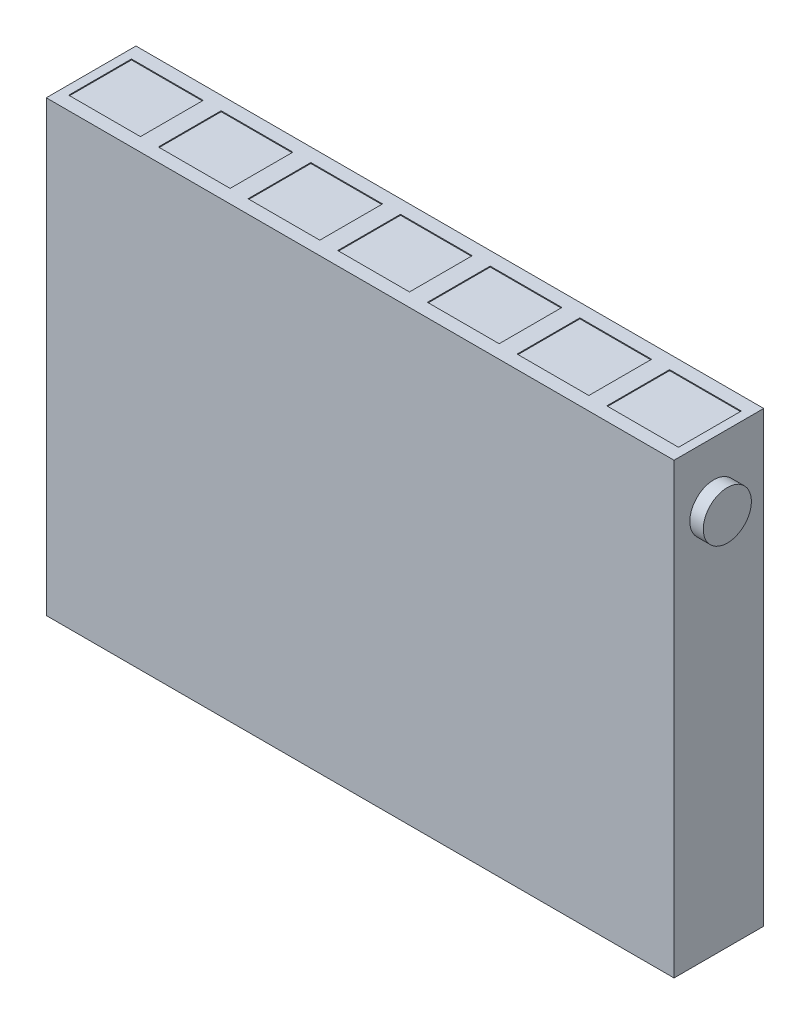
SolidWorks part; units mm, degrees
ref_plane "Plan de face" through (0, 0, 0) normal (0, 0, 1) x (1, 0, 0)
ref_plane "Plan de dessus" through (0, 0, 0) normal (0, 1, 0) x (1, 0, 0)
ref_plane "Plan de droite" through (0, 0, 0) normal (1, 0, 0) x (0, 0, -1)
sketch "Esquisse1" plane through (0, 0, 0) normal (0, 0, 1) x (1, 0, 0)
  line L1 (350, -250) -> (-350, -250)
  line L2 (350, -250) -> (350, 250)
  line L3 (350, 250) -> (-350, 250)
  line L4 (-350, -250) -> (-350, 250)
  line L5 (350, -250) -> (-350, 250) construction
  line L6 (350, 250) -> (-350, -250) construction
  point P0 (0, 0)
  dimension "D1" = 500
  dimension "D2" = 700
extrude "Boss.-Extru.1" add sketch "Esquisse1" along normal blind 100
sketch "Esquisse2" plane through (350, 0, 0) normal (1, 0, 0) x (0, 0, -1)
  circle A0 centre (-55.5847, 182.1414) radius 26.8213
extrude "Boss.-Extru.2" add sketch "Esquisse2" along normal blind 15
sketch "Esquisse3" plane through (0, 250, 0) normal (0, 1, 0) x (1, 0, 0)
  line L0 (350, 0) -> (-350, 0) construction
  line L1 (-340, -15) -> (-260, -15)
  line L2 (-340, -15) -> (-340, -85)
  line L3 (-340, -85) -> (-260, -85)
  line L4 (-260, -15) -> (-260, -85)
  line L5 (-350, -100) -> (-350, 0) construction
  line L6 (-240, -15) -> (-160, -15)
  line L7 (-240, -15) -> (-240, -85)
  line L8 (-240, -85) -> (-160, -85)
  line L9 (-160, -15) -> (-160, -85)
  line L10 (-140, -15) -> (-60, -15)
  line L11 (-140, -15) -> (-140, -85)
  line L12 (-140, -85) -> (-60, -85)
  line L13 (-60, -15) -> (-60, -85)
  line L14 (-40, -15) -> (40, -15)
  line L15 (-40, -15) -> (-40, -85)
  line L16 (-40, -85) -> (40, -85)
  line L17 (40, -15) -> (40, -85)
  line L18 (60, -15) -> (140, -15)
  line L19 (60, -15) -> (60, -85)
  line L20 (60, -85) -> (140, -85)
  line L21 (140, -15) -> (140, -85)
  line L22 (160, -15) -> (240, -15)
  line L23 (160, -15) -> (160, -85)
  line L24 (160, -85) -> (240, -85)
  line L25 (240, -15) -> (240, -85)
  line L26 (260, -15) -> (340, -15)
  line L27 (260, -15) -> (260, -85)
  line L28 (260, -85) -> (340, -85)
  line L29 (340, -15) -> (340, -85)
  dimension "D1" = 80
  dimension "D2" = 70
  dimension "D3" = 15
  dimension "D4" = 10
  dimension "D5" = 7
extrude "Enlèv. mat.-Extru.1" cut sketch "Esquisse3" against normal blind 1
